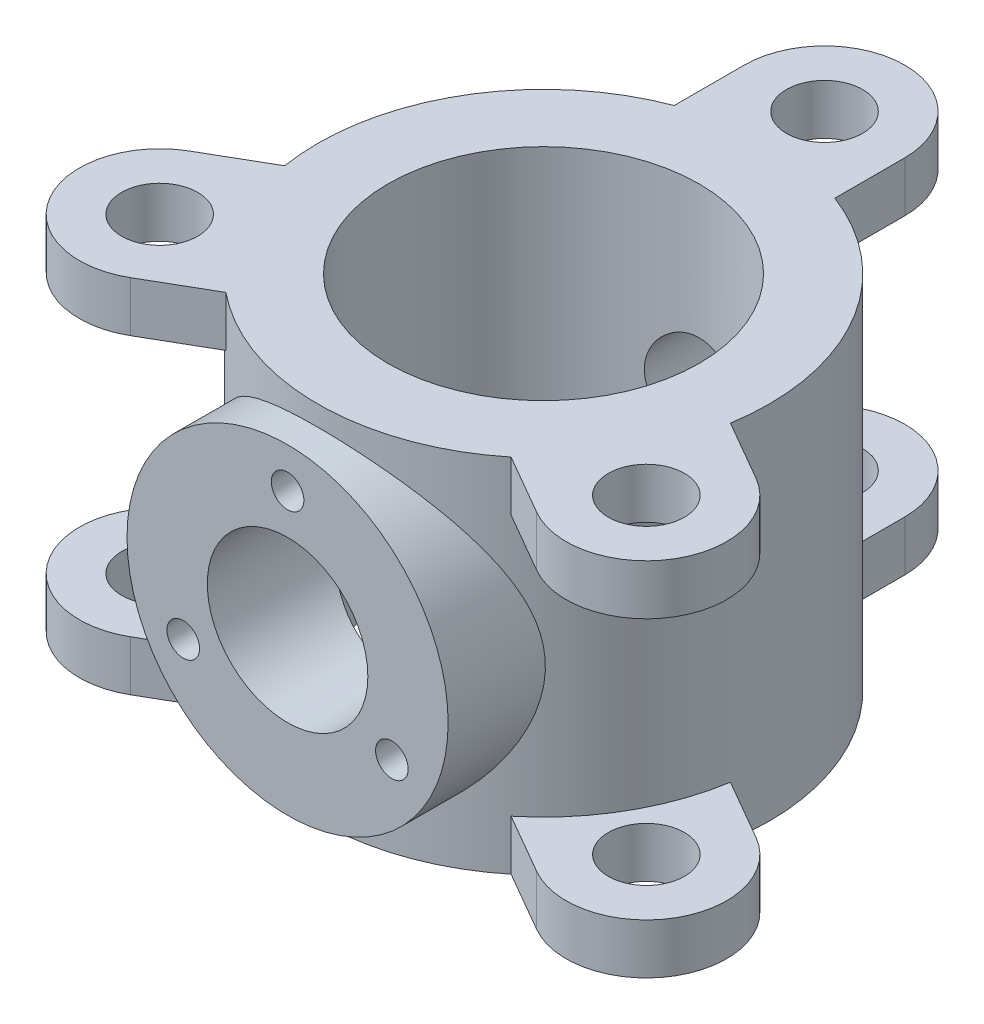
SolidWorks part; units mm, degrees
ref_plane "Front" through (0, 0, 0) normal (0, 0, 1) x (1, 0, 0)
ref_plane "Top" through (0, 0, 0) normal (0, 1, 0) x (1, 0, 0)
ref_plane "Right" through (0, 0, 0) normal (1, 0, 0) x (0, 0, -1)
sketch "Sketch1" plane through (0, 0, 0) normal (0, 1, 0) x (1, 0, 0)
  circle A0 centre (0, 0) radius 35.7124
  dimension "D1" = 71.4248
extrude "Extrude1" add sketch "Sketch1" along normal blind 28.575
sketch "Sketch2" plane through (0, 28.575, 0) normal (0, 1, 0) x (-1, 0, 0)
  line L0 (0, -35.7124) -> (0, -44.45) construction
  line L1 (-12.7, -33.3779) -> (-12.7, -44.45)
  line L2 (12.7, -33.3779) -> (12.7, -44.45)
  line L3 (12.7, 0) -> (12.7, -44.45) construction
  line L4 (0, 0) -> (0, -44.45) construction
  line L5 (-12.7, 0) -> (-12.7, -44.45) construction
  circle A0 centre (0, 0) radius 35.7124 construction
  arc A1 (-12.7, -33.3779) -> (12.7, -33.3779) centre (0, 0) ccw
  arc A3 (-12.7, -44.45) -> (12.7, -44.45) centre (0, -44.45) ccw
  dimension "D3" = 44.45
  dimension "D1" = 12.7
  dimension "D2" = 12.7
extrude "Extrude2" add sketch "Sketch2" against normal blind 7.9502
pattern_circular "CirPattern1" count 3 over 360 about axis through (0, 0, 0) along (0, 1, 0) of "Extrude2"
hole_wizard "Hole1" positions "Sketch5" profile "Sketch4" legacy
sketch "Sketch5" plane through (0, 28.575, 0) normal (0, 1, 0) x (-1, 0, 0)
  point P0 (38.4948, 22.225)
  point P1 (0, -44.45)
  point P4 (-38.4948, 22.225)
sketch "Sketch4" plane through (-38.4948, 28.575, 22.225) normal (1, 0, 0) x (0, 0, 1)
  line L0 (0, 0) -> (0, 100)
  line L1 (0, 100) -> (6.0198, 100)
  line L2 (6.0198, 100) -> (6.0198, 0)
  line L3 (6.0198, 0) -> (0, 0)
  line L4 (0, 110) -> (0, -10) construction
  dimension "Diameter" = 12.0396
  dimension "Depth" = 100
mirror "Mirror1" about plane through (0, 0, 0) normal (0, 1, 0)
sketch "Sketch6" plane through (0, 0, 0) normal (0, 0, 1) x (1, 0, 0)
  line L0 (0, 28.575) -> (0, -28.575) construction
  line L1 (22.5561, 28.575) -> (-22.5561, 28.575) construction
  line L2 (-22.5561, -28.575) -> (22.5561, -28.575) construction
  circle A0 centre (0, 0) radius 25.4
  circle A1 centre (0, 0) radius 12.7
  circle A2 centre (0, 0) radius 19.05 construction
  dimension "D1" = 50.8
  dimension "D2" = 25.4
  dimension "D3" = 38.1
extrude "Extrude3" add sketch "Sketch6" along normal offset from surface (40.4876 mm away) 40.4876
sketch "Sketch10" plane through (0, 28.575, 0) normal (0, 1, 0) x (-1, 0, 0)
  circle A0 centre (0, 0) radius 24.6126
  dimension "D1" = 49.2252
extrude "Cut-Extrude1" cut sketch "Sketch10" against normal through all
sketch "Sketch9" plane through (0, 0, 40.4876) normal (0, 0, 1) x (1, 0, 0)
  circle A0 centre (0, 0) radius 12.7 construction
  circle A1 centre (0, 0) radius 12.7
extrude "Cut-Extrude2" cut sketch "Sketch9" against normal up to next
hole_wizard "Hole2" positions "Sketch8" profile "Sketch7" legacy
sketch "Sketch8" plane through (0, 0, 40.4876) normal (0, 0, 1) x (1, 0, 0)
  line L0 (0, 12.7) -> (0, 25.4) construction
  line L2 (0, -28.575) -> (0, 28.575) construction
  circle A0 centre (0, 0) radius 25.4 construction
  circle A2 centre (0, 0) radius 12.7 construction
  point P0 (0, 19.05)
sketch "Sketch7" plane through (0, 19.05, 40.4876) normal (1, 0, 0) x (0, -1, 0)
  line L0 (0, 0) -> (0, 9.525)
  line L1 (0, 9.525) -> (2.5781, 9.525)
  line L2 (2.5781, 9.525) -> (2.5781, 0)
  line L3 (2.5781, 0) -> (0, 0)
  line L4 (0, 110) -> (0, -10) construction
  dimension "Diameter" = 5.1562
  dimension "Depth" = 9.525
pattern_circular "CirPattern2" count 3 over 360 about axis through (0, 0, 0) along (0, 0, 1) of "Hole2"
sketch "Sketch11" plane through (0, 0, 40.4876) normal (0, 0, 1) x (1, 0, 0)
  circle A0 centre (0, 0) radius 7.5
  dimension "D1" = 15
extrude "Cut-Extrude3" cut sketch "Sketch11" against normal through all
sketch "Sketch12" plane through (0, 0, 0) normal (1, 0, 0) x (0, 0, -1)
  line L0 (34.1376, 7.5) -> (39.1249, 7.5)
  line L1 (40.7124, 0) -> (40.7124, 9.0875)
  line L2 (40.7124, 9.0875) -> (34.1376, 9.0875)
  line L3 (35.7124, 7.5) -> (24.6126, 7.5) construction
  line L5 (35.7124, 7.5) -> (35.7124, 20.6248) construction
  line L6 (0, 0) -> (48.9218, 0) construction
  line L7 (34.1376, 7.5) -> (34.1376, 9.0875)
  line L8 (24.6126, 7.5) -> (24.6126, 28.575) construction
  line L10 (39.1249, 7.5) -> (39.1249, 0)
  line L11 (39.1249, 0) -> (40.7124, 0)
  dimension "D1" = 1.5875
  dimension "D2" = 5
  dimension "D3" = 9.525
revolve "Revolve1" add sketch "Sketch12" angle 360 about L6
